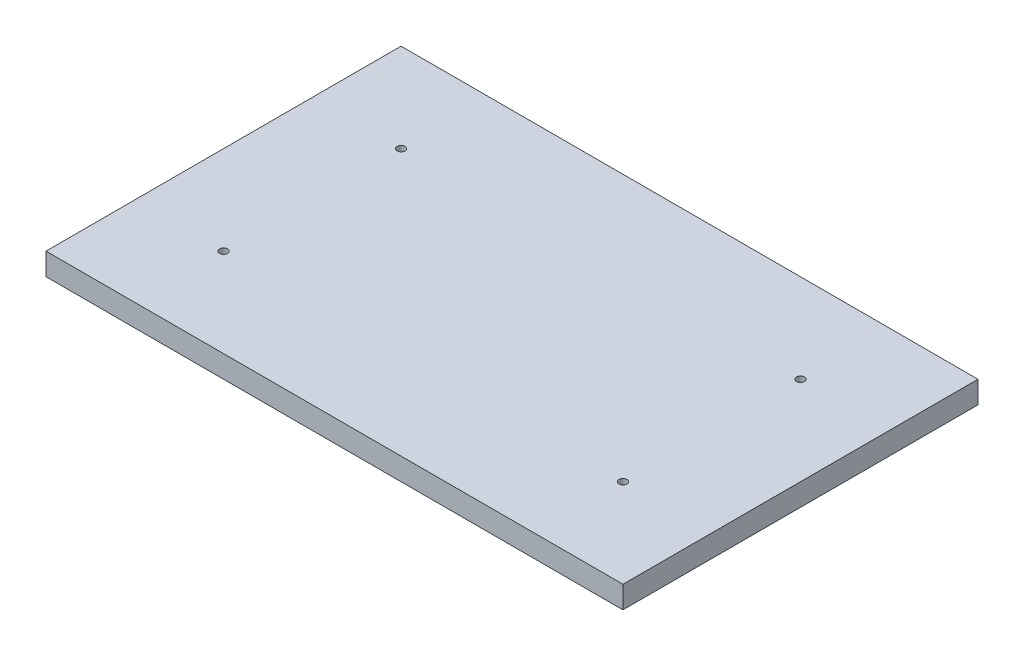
SolidWorks part; units mm, degrees
ref_plane "Front Plane" through (0, 0, 0) normal (0, 0, 1) x (1, 0, 0)
ref_plane "Top Plane" through (0, 0, 0) normal (0, 1, 0) x (1, 0, 0)
ref_plane "Right Plane" through (0, 0, 0) normal (1, 0, 0) x (0, 0, -1)
sketch "Sketch1" plane through (0, 0, 0) normal (0, 1, 0) x (1, 0, 0)
  line L1 (-111.4819, 55.2509) -> (53.6181, 55.2509)
  line L2 (-111.4819, 55.2509) -> (-111.4819, -46.3491)
  line L3 (-111.4819, -46.3491) -> (53.6181, -46.3491)
  line L4 (53.6181, 55.2509) -> (53.6181, -46.3491)
  dimension "D1" = 101.6
  dimension "D2" = 165.1
extrude "Extrude1" add sketch "Sketch1" along normal blind 6.35
hole_wizard "#4-40 Tapped Hole1" positions "Sketch3" profile "Sketch2" tap size "#4-40" standard "Ansi Inch"
sketch "Sketch3" plane through (0, 6.35, 0) normal (0, 1, 0) x (-1, 0, 0)
  line L0 (111.4819, 46.3491) -> (-53.6181, 46.3491) construction
  line L1 (111.4819, -55.2509) -> (111.4819, 46.3491) construction
  line L4 (-53.6181, -55.2509) -> (111.4819, -55.2509) construction
  line L5 (-53.6181, 46.3491) -> (-53.6181, -55.2509) construction
  point P0 (86.0819, 20.9491)
  point P1 (86.0819, -29.8509)
  point P3 (-28.2181, -29.8509)
  point P5 (-28.2181, 20.9491)
  dimension "D1" = 25.4
  dimension "D2" = 25.4
  dimension "D3" = 25.4
  dimension "D4" = 25.4
  dimension "D5" = 25.4
  dimension "D6" = 25.4
  dimension "D7" = 25.4
  dimension "D8" = 25.4
sketch "Sketch2" plane through (-86.0819, 6.35, 20.9491) normal (1, 0, 0) x (0, 0, 1)
  line L0 (0, 0) -> (0, 8.2992)
  line L1 (0, 8.2992) -> (1.1303, 7.62)
  line L2 (1.1303, 7.62) -> (1.1303, 0)
  line L5 (1.1303, 0) -> (0, 0)
  line L10 (0, 8.2992) -> (-1.1303, 7.62) construction
  line L11 (0, -6.35) -> (0, 107.95) construction
  dimension "Tap Drill Dia." = 2.2606
  dimension "Tap Drill Depth" = 7.62
  dimension "Drill Angle" = 118
